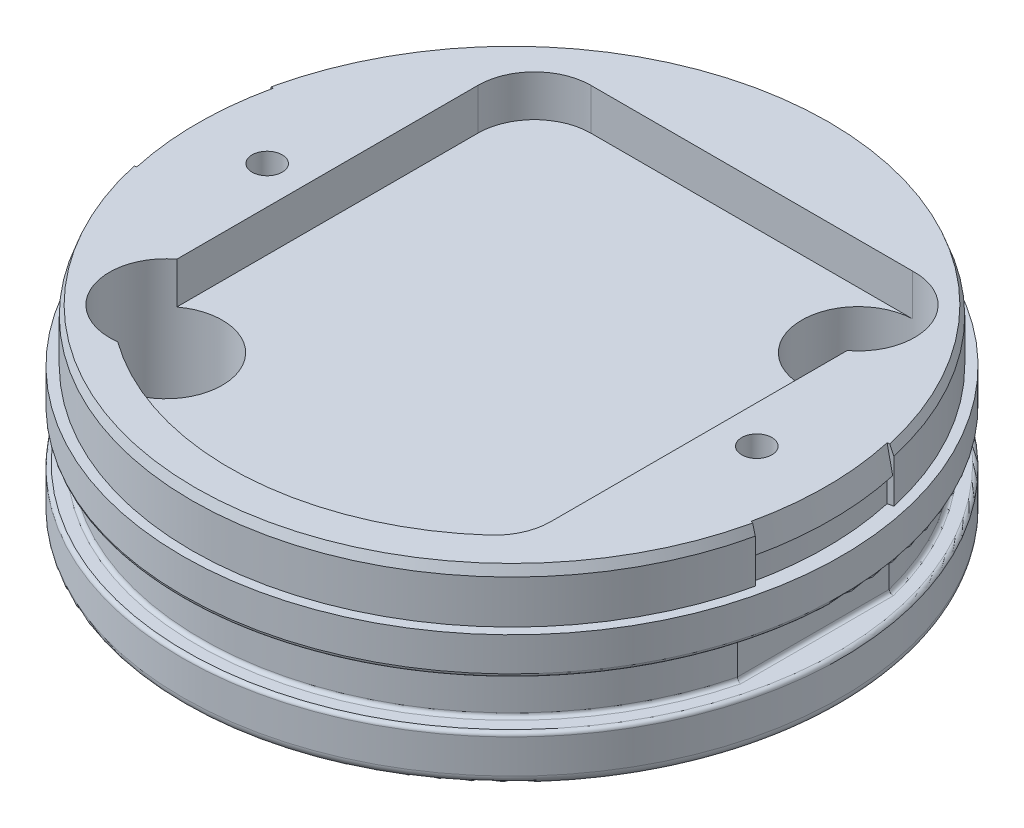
SolidWorks part; units mm, degrees
ref_plane "Front Plane" through (0, 0, 0) normal (0, 0, 1) x (1, 0, 0)
ref_plane "Top Plane" through (0, 0, 0) normal (0, 1, 0) x (1, 0, 0)
ref_plane "Right Plane" through (0, 0, 0) normal (1, 0, 0) x (0, 0, -1)
sketch "Sketch1" plane through (0, 0, 0) normal (0, 1, 0) x (1, 0, 0)
  line L0 (-13, 0) -> (0, 0) construction
  line L1 (0, 0) -> (13, 0) construction
  line L2 (0, 0) -> (9.1924, 9.1924) construction
  line L3 (0, 0) -> (-9.1924, -9.1924) construction
  circle A0 centre (0, 0) radius 17.5
  circle A1 centre (-13, 0) radius 0.8 construction
  circle A2 centre (13, 0) radius 0.8 construction
  circle A3 centre (0, 0) radius 4.61
  circle A4 centre (-9.1924, -9.1924) radius 1.25
  circle A5 centre (9.1924, 9.1924) radius 1.25
  dimension "D1" = 35
  dimension "D2" = 13
  dimension "D3" = 13
  dimension "D4" = 1.6
  dimension "D5" = 1.6
  dimension "D6" = 9.22
  dimension "D7" = 2.5
  dimension "D8" = 2.5
  dimension "D9" = 13
  dimension "D10" = 13
  dimension "D11" = 45
  dimension "D12" = 45
  dimension "D13" = 9.1924
  dimension "D14" = 9.1924
  dimension "D15" = 9.1924
  dimension "D16" = 9.1924
extrude "Boss-Extrude1" add sketch "Sketch1" along normal blind 9.8
sketch "Sketch3" plane through (0, 9.8, 0) normal (0, 1, 0) x (1, 0, 0)
  circle A0 centre (-9.1924, -9.1924) radius 3
  circle A1 centre (9.1924, 9.1924) radius 3
  dimension "D1" = 6
  dimension "D2" = 6
extrude "Cut-Extrude2" cut sketch "Sketch3" against normal blind 7.3
sketch "Sketch2" plane through (0, 9.8, 0) normal (0, 1, 0) x (1, 0, 0)
  line L1 (-18.8729, 0) -> (19.5048, 0) construction
  line L2 (-11, 9.19) -> (-11, -6.7981)
  line L3 (11, 6.7981) -> (11, -8.9443)
  line L4 (9.0727, 12.19) -> (-8, 12.19)
  arc A0 (-8, 12.19) -> (-11, 9.19) centre (-8, 9.19) ccw
  arc A1 (11, -8.9443) -> (10, -11.1803) centre (8, -8.9443) cw
  circle A6 centre (0, 0) radius 4.61 construction
  circle A7 centre (0, 0) radius 17
  arc A8 (10, -11.1803) -> (-8.7777, -12.1636) centre (0, 0) cw
  circle A13 centre (-9.1924, -9.1924) radius 3
  arc A14 (-11, -6.7981) -> (-8.7777, -12.1636) centre (-9.1924, -9.1924) ccw
  circle A16 centre (9.1924, 9.1924) radius 3
  arc A17 (11, 6.7981) -> (9.0727, 12.19) centre (9.1924, 9.1924) ccw
  dimension "D1" = 15
  dimension "D2" = 0
  dimension "D4" = 11
  dimension "D5" = 34
  dimension "D3" = 11
  dimension "D8" = 12.19
  dimension "D6" = 0
  dimension "D7" = 3
  dimension "D9" = 3
  dimension "D10" = 3
  dimension "D11" = 3
  dimension "D12" = 90
extrude "Cut-Extrude1" cut sketch "Sketch2" against normal blind 2.5 flip side to cut
sketch "Sketch4" plane through (0, 9.8, 0) normal (0, 1, 0) x (1, 0, 0)
  line L0 (-13, 0) -> (0, 0) construction
  line L1 (0, 0) -> (13, 0) construction
  circle A0 centre (-13, 0) radius 0.8
  circle A1 centre (13, 0) radius 0.8
  circle A2 centre (0, 0) radius 4.61 construction
  dimension "D1" = 13
  dimension "D2" = 13
  dimension "D3" = 1.6
  dimension "D4" = 1.6
extrude "Cut-Extrude3" cut sketch "Sketch4" against normal blind 6
sketch "Sketch5" plane through (0, 3.8, 0) normal (0, 1, 0) x (1, 0, 0)
  circle A2 centre (-13, 0) radius 0.8
  circle A3 centre (-13, 0) radius 0.8
  circle A5 centre (13, 0) radius 0.8
  circle A6 centre (13, 0) radius 0.8
  dimension "D1" = 0
  dimension "D2" = 0
extrude "Cut-Extrude4" cut sketch "Sketch5" against normal blind 2 draft 55
sketch "Sketch7" plane through (0, 7.3, 0) normal (0, 1, 0) x (1, 0, 0)
  line L6 (11, -8.9443) -> (11, 6.7981)
  line L7 (9.0727, 12.19) -> (-8, 12.19)
  line L8 (-11, 9.19) -> (-11, -6.7981)
  line L9 (11, -8.9443) -> (11, 6.7981)
  line L10 (9.0727, 12.19) -> (-8, 12.19)
  line L11 (-11, 9.19) -> (-11, -6.7981)
  arc A10 (-8.7777, -12.1636) -> (-11, -6.7981) centre (-9.1924, -9.1924) ccw
  arc A11 (-8.7777, -12.1636) -> (10, -11.1803) centre (0, 0) ccw
  arc A12 (10, -11.1803) -> (11, -8.9443) centre (8, -8.9443) ccw
  arc A13 (9.0727, 12.19) -> (11, 6.7981) centre (9.1924, 9.1924) ccw
  arc A14 (-8, 12.19) -> (-11, 9.19) centre (-8, 9.19) ccw
  arc A15 (-8.7777, -12.1636) -> (-11, -6.7981) centre (-9.1924, -9.1924) ccw
  arc A16 (-8.7777, -12.1636) -> (10, -11.1803) centre (0, 0) ccw
  arc A17 (10, -11.1803) -> (11, -8.9443) centre (8, -8.9443) ccw
  arc A18 (9.0727, 12.19) -> (11, 6.7981) centre (9.1924, 9.1924) ccw
  arc A19 (-8, 12.19) -> (-11, 9.19) centre (-8, 9.19) ccw
  dimension "D1" = 0
extrude "Boss-Extrude2" add sketch "Sketch7" along normal blind 0.3
sketch "Sketch8" plane through (0, 7.3, 0) normal (0, 1, 0) x (1, 0, 0)
  circle A2 centre (0, 0) radius 17.5
  circle A3 centre (0, 0) radius 17.5
  circle A5 centre (0, 0) radius 17
  circle A6 centre (0, 0) radius 17
  dimension "D1" = 0
  dimension "D2" = 0
extrude "Cut-Extrude5" cut sketch "Sketch8" against normal blind 0.3
sketch "Sketch6" plane through (0, 0, 0) normal (0, 0, 1) x (1, 0, 0)
  line L0 (0, 5.8506) -> (0, 0) construction
  line L1 (17, 9.8) -> (-17, 9.8) construction
  line L2 (16.7, 8.2912) -> (16.95, 8.3822)
  line L3 (19.3386, 11.128) -> (19.3386, 7)
  line L4 (16.7, 11.128) -> (19.3386, 11.128)
  line L7 (-16.7, 11.128) -> (-16.7, 9.8)
  line L8 (-16.7, 9.8) -> (-16.95, 8.3822)
  line L9 (-16.7, 8.2912) -> (-16.7, 7)
  line L10 (16.7, 7) -> (19.3386, 7)
  line L11 (-16.7, 11.128) -> (-19.3386, 11.128)
  line L12 (-19.3386, 11.128) -> (-19.3386, 7)
  line L13 (-16.7, 8.2912) -> (-16.95, 8.3822)
  line L14 (16.7, 8.2912) -> (16.7, 7)
  line L15 (16.7, 9.8) -> (16.95, 8.3822)
  line L16 (16.7, 11.128) -> (16.7, 9.8)
  line L17 (-16.7, 7) -> (-19.3386, 7)
  dimension "D2" = 0
  dimension "D3" = 16.7
  dimension "D6" = 110
  dimension "D7" = 170
  dimension "D8" = 16.7
  dimension "D9" = 16.7
  dimension "D10" = 16.95
revolve "Cut-Revolve1" cut sketch "Sketch6" angle 25 mid plane about L0
chamfer "Chamfer2" distance 0.5 angle 20 1 edges at (0, 9.8, 17)
fillet "Fillet1" radius 1.5 1 edges at (0, 7.3, 4.61)
fillet "Fillet3" radius 0.3 1 edges at (0, 0, 4.61)
fillet "Fillet4" radius 0.5 1 edges at (0, 0, 17.5)
sketch "Sketch9" plane through (0, 0, 0) normal (0, 0, 1) x (1, 0, 0)
  line L0 (-17, 0) -> (17, 0) construction
  line L1 (17.3, 5) -> (16.7, 5)
  line L2 (17.5, 5.2) -> (17.5, 12.3909)
  line L3 (17.3, 2.5) -> (16.7, 2.5)
  line L4 (16.5, 4.8) -> (16.5, 2.7)
  line L5 (0, 0) -> (0, 6.2169) construction
  line L6 (17.5, -2.0733) -> (17.5, 2.3)
  line L7 (17.5, 0.5) -> (17.5, 7) construction
  line L8 (17.5, 12.3909) -> (25.7797, 12.3909)
  line L9 (25.7797, 12.3909) -> (25.7797, -2.0733)
  line L10 (25.7797, -2.0733) -> (17.5, -2.0733)
  arc A0 (16.7, 2.5) -> (16.5, 2.7) centre (16.7, 2.7) cw
  arc A1 (16.7, 5) -> (16.5, 4.8) centre (16.7, 4.8) ccw
  arc A2 (17.3, 2.5) -> (17.5, 2.3) centre (17.3, 2.3) cw
  arc A3 (17.3, 5) -> (17.5, 5.2) centre (17.3, 5.2) ccw
  point P24 (17.5, 5)
  dimension "D4" = 0.2
  dimension "D5" = 0.2
  dimension "D1" = 2.5
  dimension "D2" = 2.5
  dimension "D3" = 16.5
revolve "Cut-Revolve2" cut sketch "Sketch9" angle 360 about L5
sketch "Sketch11" plane through (0, 5, 0) normal (0, -1, 0) x (1, 0, 0)
  line L1 (-21.3685, -9.3948) -> (-16, -9.3948)
  line L2 (-21.3685, -9.3948) -> (-21.3685, 7.9714)
  line L3 (-21.3685, 7.9714) -> (-16, 7.9714)
  line L4 (-16, -9.3948) -> (-16, 7.9714)
  line L5 (17.7081, -10.5336) -> (16, -10.5336)
  line L6 (17.7081, -10.5336) -> (17.7081, 12.2011)
  line L7 (17.7081, 12.2011) -> (16, 12.2011)
  line L8 (16, -10.5336) -> (16, 12.2011)
  circle A0 centre (0, 0) radius 17.5 construction
  dimension "D1" = 16
  dimension "D2" = 16
extrude "Cut-Extrude7" cut sketch "Sketch11" along normal up to surface (2.5 mm away)
sketch "Sketch10" plane through (0, 9.8, 0) normal (0, 1, 0) x (1, 0, 0)
  line L0 (0, 0) -> (-9.1924, -9.1924)
  line L1 (0, 0) -> (9.1924, 9.1924)
  line L2 (9.1924, 9.1924) -> (14.4922, 14.4922)
  line L3 (-9.1924, -9.1924) -> (-14.0993, -14.5955)
  line L4 (-14.0993, -14.5955) -> (1.7265, -20.7583)
  line L5 (1.7265, -20.7583) -> (18.7073, -15.5836)
  line L6 (18.7073, -15.5836) -> (21.6556, 0.6318)
  line L7 (21.6556, 0.6318) -> (14.4922, 14.4922)
extrude "Cut-Extrude6" [suppressed] cut sketch "Sketch10" against normal blind 33
fillet "Fillet5" radius 0.2 4 edges at (-16, 5, 0) (-16, 2.5, 0) (16, 2.5, 0) (16, 5, 0)
chamfer "Chamfer3" [suppressed] distance 0.1 angle 45
